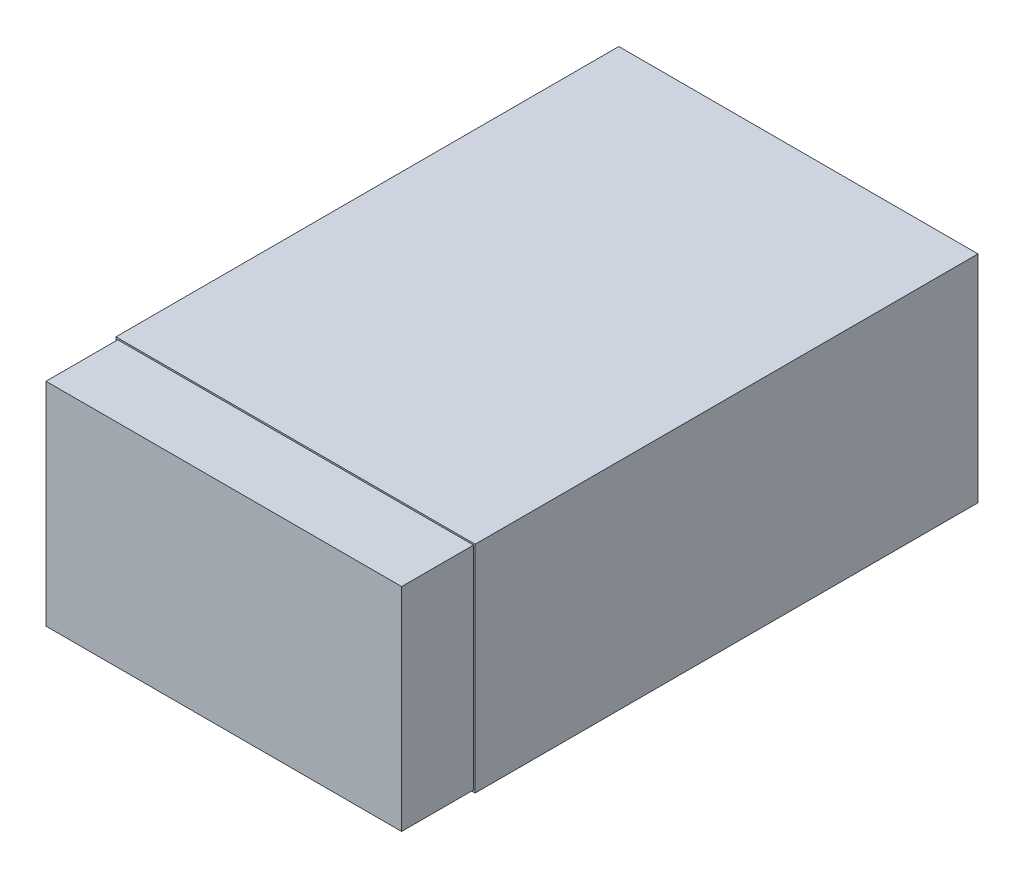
SolidWorks part; units mm, degrees
ref_plane "Front Plane" through (0, 0, 0) normal (0, 0, 1) x (1, 0, 0)
ref_plane "Top Plane" through (0, 0, 0) normal (0, 1, 0) x (1, 0, 0)
ref_plane "Right Plane" through (0, 0, 0) normal (1, 0, 0) x (0, 0, -1)
sketch "Sketch2" plane through (0, 0, 0) normal (0, 0, 1) x (1, 0, 0)
  line L1 (0, 0) -> (25, 0)
  line L2 (0, 0) -> (0, 15)
  line L3 (0, 15) -> (25, 15)
  line L4 (25, 0) -> (25, 15)
  dimension "D1" = 25
  dimension "D2" = 15
extrude "Boss-Extrude1" add sketch "Sketch2" along normal blind 35
sketch "Sketch4" plane through (0, 0, 35) normal (0, 0, 1) x (1, 0, 0)
  line L1 (0.1345, 14.8915) -> (24.8854, 14.8915)
  line L2 (0.1345, 14.8915) -> (0.1345, 0.1284)
  line L3 (0.1345, 0.1284) -> (24.8854, 0.1284)
  line L4 (24.8854, 14.8915) -> (24.8854, 0.1284)
extrude "Boss-Extrude4" add sketch "Sketch4" along normal blind 5
